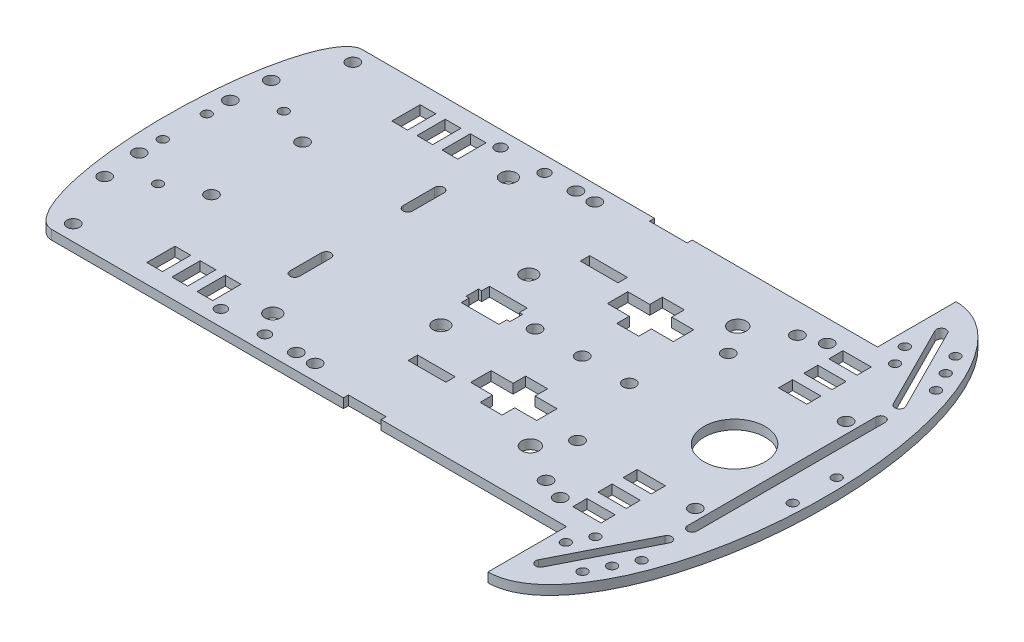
SolidWorks part; units mm, degrees
ref_plane "Front Plane" through (0, 0, 0) normal (0, 0, 1) x (1, 0, 0)
ref_plane "Top Plane" through (0, 0, 0) normal (0, 1, 0) x (1, 0, 0)
ref_plane "Right Plane" through (0, 0, 0) normal (1, 0, 0) x (0, 0, -1)
sketch "Sketch1" plane through (0, 0, 0) normal (0, 1, 0) x (1, 0, 0)
  line L1 (0, 0) -> (210, 0)
  line L2 (0, 0) -> (0, 149)
  line L3 (0, 149) -> (210, 149)
  line L4 (210, 0) -> (210, 149)
  dimension "D1" = 210
  dimension "D2" = 149
extrude "Boss-Extrude1" add sketch "Sketch1" along normal blind 3
sketch "Sketch2" plane through (0, 3, 0) normal (0, 1, 0) x (1, 0, 0)
  line L0 (210, 149) -> (0, 149) construction
  line L1 (177, 149) -> (0, 149)
  line L2 (177, 149) -> (177, 124)
  line L3 (177, 124) -> (0, 124)
  line L4 (0, 149) -> (0, 124)
  line L5 (0, 149) -> (0, 0) construction
  line L7 (0, 0) -> (177, 0)
  line L8 (0, 0) -> (0, 25)
  line L9 (0, 25) -> (177, 25)
  line L10 (177, 0) -> (177, 25)
  dimension "D1" = 177
  dimension "D2" = 25
  dimension "D3" = 25
extrude "Cut-Extrude1" cut sketch "Sketch2" against normal blind 3
sketch "Sketch3" plane through (0, 3, 0) normal (0, 1, 0) x (1, 0, 0)
  line L0 (0, 124) -> (177, 124) construction
  line L1 (143, 99.5) -> (122, 99.5)
  line L2 (143, 99.5) -> (143, 93)
  line L3 (143, 93) -> (122, 93)
  line L4 (122, 99.5) -> (122, 93)
  line L5 (129, 103.5) -> (136, 103.5)
  line L6 (129, 103.5) -> (129, 89)
  line L7 (129, 89) -> (136, 89)
  line L8 (136, 103.5) -> (136, 89)
  line L9 (177, 124) -> (177, 149) construction
  line L10 (118, 124) -> (106, 124)
  line L11 (118, 124) -> (118, 122.4)
  line L12 (118, 122.4) -> (106, 122.4)
  line L13 (106, 124) -> (106, 122.4)
  line L14 (210, 74.5) -> (0, 74.5) construction
  line L15 (118, 103.4) -> (106, 103.4)
  line L16 (118, 103.4) -> (118, 100.4)
  line L17 (118, 100.4) -> (106, 100.4)
  line L18 (106, 103.4) -> (106, 100.4)
  line L19 (181.5, 117.5) -> (172.5, 117.5)
  line L20 (181.5, 117.5) -> (181.5, 113)
  line L21 (181.5, 113) -> (172.5, 113)
  line L22 (172.5, 117.5) -> (172.5, 113)
  line L23 (172.5, 109.5) -> (181.5, 109.5)
  line L24 (172.5, 109.5) -> (172.5, 105)
  line L25 (172.5, 105) -> (181.5, 105)
  line L26 (181.5, 109.5) -> (181.5, 105)
  line L27 (172.5, 101.5) -> (181.5, 101.5)
  line L28 (172.5, 101.5) -> (172.5, 97)
  line L29 (172.5, 97) -> (181.5, 97)
  line L30 (181.5, 101.5) -> (181.5, 97)
  line L31 (210, 0) -> (210, 149) construction
  line L32 (0, 124) -> (0, 25) construction
  line L33 (181.5, 47.5) -> (181.5, 52)
  line L34 (172.5, 52) -> (181.5, 52)
  line L35 (172.5, 47.5) -> (172.5, 52)
  line L36 (172.5, 47.5) -> (181.5, 47.5)
  line L37 (181.5, 39.5) -> (181.5, 44)
  line L38 (172.5, 44) -> (181.5, 44)
  line L39 (172.5, 39.5) -> (172.5, 44)
  line L40 (172.5, 39.5) -> (181.5, 39.5)
  line L41 (172.5, 31.5) -> (172.5, 36)
  line L42 (181.5, 36) -> (172.5, 36)
  line L43 (181.5, 31.5) -> (181.5, 36)
  line L44 (181.5, 31.5) -> (172.5, 31.5)
  line L45 (106, 45.6) -> (106, 48.6)
  line L46 (118, 48.6) -> (106, 48.6)
  line L47 (118, 45.6) -> (118, 48.6)
  line L48 (118, 45.6) -> (106, 45.6)
  line L49 (106, 25) -> (106, 26.6)
  line L50 (118, 26.6) -> (106, 26.6)
  line L51 (118, 25) -> (118, 26.6)
  line L52 (118, 25) -> (106, 25)
  line L53 (136, 45.5) -> (136, 60)
  line L54 (129, 60) -> (136, 60)
  line L55 (129, 45.5) -> (129, 60)
  line L56 (129, 45.5) -> (136, 45.5)
  line L57 (122, 49.5) -> (122, 56)
  line L58 (143, 56) -> (122, 56)
  line L59 (143, 49.5) -> (143, 56)
  line L60 (143, 49.5) -> (122, 49.5)
  circle A0 centre (149, 107.5) radius 2.75
  circle A1 centre (168, 117) radius 2
  circle A2 centre (161, 114.5) radius 2
  circle A3 centre (155, 98.5) radius 2
  circle A4 centre (155, 50.5) radius 2
  circle A5 centre (161, 34.5) radius 2
  circle A6 centre (168, 32) radius 2
  circle A7 centre (149, 41.5) radius 2.75
  dimension "D16" = 5.5
  dimension "D19" = 9
  dimension "D21" = 4
  dimension "D25" = 4
  dimension "D27" = 4
  dimension "D1" = 34
  dimension "D2" = 6.5
  dimension "D3" = 24.5
  dimension "D4" = 21
  dimension "D5" = 7
  dimension "D6" = 7
  dimension "D7" = 4
  dimension "D8" = 4
  dimension "D9" = 59
  dimension "D10" = 12
  dimension "D11" = 1.6
  dimension "D12" = 3
  dimension "D13" = 19
  dimension "D14" = 12
  dimension "D15" = 59
  dimension "D17" = 28
  dimension "D18" = 16.5
  dimension "D20" = 7
  dimension "D22" = 16
  dimension "D23" = 9.5
  dimension "D24" = 25.5
  dimension "D26" = 22
  dimension "D28" = 4.5
  dimension "D29" = 9
  dimension "D30" = 4.5
  dimension "D31" = 6.5
  dimension "D32" = 4.5
  dimension "D33" = 3.5
  dimension "D34" = 9
  dimension "D35" = 4.5
  dimension "D36" = 3.5
extrude "Cut-Extrude2" cut sketch "Sketch3" against normal blind 3 contours L15 L18 L17 L16 | L6 L1 L4 L3 | L8 L1 L6 L3 | L1 L8 L3 L2 | L8 L3 L6 L7 | L8 L5 L6 L1 | A3 | A0 | A2 | A1 | L19 L22 L21 L20 | L26 L23 L24 L25 | L30 L27 L28 L29 | L48 L47 L46 L45 | L10 L13 L12 L11 | L50 L49 L52 L51 | L55 L54 L53 L56 | L58 L57 L60 L59 | A7 | A4 | A5 | A6 | L34 L33 L36 L35 | L38 L37 L40 L39 | L42 L41 L44 L43
sketch "Sketch4" plane through (0, 3, 0) normal (0, 1, 0) x (1, 0, 0)
  line L0 (0, 124) -> (106, 124) construction
  line L1 (106, 124) -> (106, 122.4) construction
  line L2 (106, 124) -> (106, 122.4) construction
  line L3 (210, 74.5) -> (0, 74.5) construction
  line L4 (210, 0) -> (210, 149) construction
  line L5 (0, 124) -> (0, 25) construction
  circle A0 centre (92, 119) radius 2
  circle A1 centre (86, 119) radius 2
  circle A2 centre (76, 119) radius 1.75
  circle A3 centre (62, 119) radius 1.75
  circle A4 centre (71.5, 112) radius 2.5
  circle A5 centre (71.5, 37) radius 2.5
  circle A6 centre (62, 30) radius 1.75
  circle A7 centre (76, 30) radius 1.75
  circle A8 centre (86, 30) radius 2
  circle A9 centre (92, 30) radius 2
  circle A10 centre (15, 119) radius 2
  circle A11 centre (15, 30) radius 2
  point P11 (106, 123.2)
  point P16 (106, 123.2)
  dimension "D1" = 4
  dimension "D2" = 4
  dimension "D6" = 5
  dimension "D8" = 3.5
  dimension "D12" = 3.5
  dimension "D13" = 5
  dimension "D17" = 4
  dimension "D3" = 6
  dimension "D4" = 14
  dimension "D5" = 5
  dimension "D7" = 30
  dimension "D9" = 5
  dimension "D10" = 14
  dimension "D11" = 5
  dimension "D14" = 34.5
  dimension "D15" = 12
  dimension "D16" = 47
  dimension "D18" = 5
extrude "Cut-Extrude3" cut sketch "Sketch4" against normal blind 3
sketch "Sketch5" plane through (0, 3, 0) normal (0, 1, 0) x (1, 0, 0)
  line L0 (0, 124) -> (106, 124) construction
  line L1 (58.4, 118) -> (53.4, 118)
  line L2 (58.4, 118) -> (58.4, 109)
  line L3 (58.4, 109) -> (53.4, 109)
  line L4 (53.4, 118) -> (53.4, 109)
  line L5 (0, 74.5) -> (210, 74.5) construction
  line L6 (50.4, 118) -> (45.4, 118)
  line L7 (50.4, 118) -> (50.4, 109)
  line L8 (50.4, 109) -> (45.4, 109)
  line L9 (45.4, 118) -> (45.4, 109)
  line L10 (42.4, 118) -> (37.4, 118)
  line L11 (42.4, 118) -> (42.4, 109)
  line L12 (42.4, 109) -> (37.4, 109)
  line L13 (37.4, 118) -> (37.4, 109)
  line L14 (0, 124) -> (0, 25) construction
  line L15 (210, 0) -> (210, 149) construction
  line L16 (37.4, 31) -> (37.4, 40)
  line L17 (42.4, 40) -> (37.4, 40)
  line L18 (42.4, 31) -> (42.4, 40)
  line L19 (42.4, 31) -> (37.4, 31)
  line L20 (45.4, 31) -> (45.4, 40)
  line L21 (50.4, 40) -> (45.4, 40)
  line L22 (50.4, 31) -> (50.4, 40)
  line L23 (50.4, 31) -> (45.4, 31)
  line L24 (53.4, 31) -> (53.4, 40)
  line L25 (58.4, 40) -> (53.4, 40)
  line L26 (58.4, 31) -> (58.4, 40)
  line L27 (58.4, 31) -> (53.4, 31)
  dimension "D1" = 5
  dimension "D2" = 9
  dimension "D3" = 47.6
  dimension "D4" = 6
  dimension "D5" = 5
  dimension "D6" = 5
  dimension "D7" = 3
  dimension "D8" = 3
  dimension "D9" = 9
  dimension "D10" = 9
extrude "Cut-Extrude4" cut sketch "Sketch5" against normal blind 3
sketch "Sketch6" plane through (0, 3, 0) normal (0, 1, 0) x (1, 0, 0)
  line L0 (0, 74.5) -> (210, 74.5) construction
  line L1 (0, 124) -> (0, 25) construction
  line L2 (210, 0) -> (210, 149) construction
  line L3 (29, 60) -> (29, 89)
  line L4 (29, 60) -> (6, 60)
  line L5 (29, 89) -> (6, 89)
  line L6 (6, 60) -> (6, 89)
  line L7 (29, 60) -> (6, 89) construction
  line L8 (29, 89) -> (6, 60) construction
  line L9 (0, 74.5) -> (46.1912, 74.5) construction
  circle A0 centre (6, 89) radius 2
  circle A1 centre (29, 89) radius 2
  circle A2 centre (29, 60) radius 2
  circle A3 centre (6, 60) radius 2
  circle A4 centre (6, 81.5) radius 1.5
  circle A5 centre (6, 67.5) radius 1.5
  circle A6 centre (7, 48) radius 2
  circle A7 centre (17.5, 54.5) radius 1.5
  circle A8 centre (17.5, 94.5) radius 1.5
  circle A9 centre (7, 101) radius 2
  point P7 (17.5, 74.5)
  dimension "D4" = 4
  dimension "D5" = 4
  dimension "D6" = 4
  dimension "D7" = 4
  dimension "D8" = 3
  dimension "D9" = 3
  dimension "D12" = 12
  dimension "D14" = 20
  dimension "D1" = 29
  dimension "D2" = 23
  dimension "D3" = 6
  dimension "D10" = 14
  dimension "D11" = 7
  dimension "D13" = 1
sketch "Sketch7" plane through (0, 3, 0) normal (0, 1, 0) x (1, 0, 0)
  line L0 (0, 74.5) -> (210, 74.5) construction
  line L1 (210, 0) -> (210, 149) construction
  line L2 (172.5, 101.5) -> (172.5, 97) construction
  line L3 (106, 103.4) -> (106, 100.4) construction
  line L4 (98.5, 79) -> (110.5, 79)
  line L5 (98.5, 79) -> (98.5, 70)
  line L6 (98.5, 70) -> (110.5, 70)
  line L7 (110.5, 79) -> (110.5, 70)
  line L8 (97.5, 76.5) -> (111.5, 76.5)
  line L9 (97.5, 76.5) -> (97.5, 72.5)
  line L10 (97.5, 72.5) -> (111.5, 72.5)
  line L11 (111.5, 76.5) -> (111.5, 72.5)
  line L12 (77.2099, 74.5) -> (123.0417, 74.5) construction
  circle A0 centre (181, 74.5) radius 9.75
  circle A1 centre (132.5, 74.5) radius 2
  circle A2 centre (147.5, 74.5) radius 2
  circle A3 centre (117.5, 74.5) radius 2
  circle A4 centre (101.5, 88.5) radius 2.5
  circle A5 centre (101.5, 60.5) radius 2.5
  point P28 (106, 101.9)
  dimension "D1" = 19.5
  dimension "D3" = 15
  dimension "D16" = 5
  dimension "D2" = 29
  dimension "D4" = 15
  dimension "D5" = 3.5
  dimension "D6" = 9
  dimension "D7" = 4.5
  dimension "D8" = 12
  dimension "D9" = 14
  dimension "D10" = 4
  dimension "D11" = 2
  dimension "D12" = 1
  dimension "D13" = 6
  dimension "D14" = 14
  dimension "D15" = 4.5
extrude "Cut-Extrude5" cut sketch "Sketch7" against normal blind 3 contours A4 | A5 | L10 L5 L6 L7 | A3 | A1 | A2 | A0
extrude "Cut-Extrude6" cut sketch "Sketch6" against normal blind 3 contours A9 | A8 | A0 | A1 | A2 | A4 | A5 | A3 | A7 | A6
sketch "Sketch8" plane through (0, 3, 0) normal (0, 1, 0) x (1, 0, 0)
  line L0 (64, 97.5) -> (64, 87.5) construction
  line L1 (65.5, 97.5) -> (65.5, 87.5)
  line L2 (62.5, 97.5) -> (62.5, 87.5)
  line L3 (0, 74.5) -> (210, 74.5) construction
  line L4 (0, 124) -> (0, 25) construction
  line L5 (210, 0) -> (210, 149) construction
  line L6 (0, 124) -> (106, 124) construction
  line L7 (98.5, 79) -> (98.5, 76.5) construction
  line L8 (36.7858, 74.5) -> (83.2541, 74.5) construction
  line L9 (64, 51.5) -> (64, 61.5) construction
  line L10 (65.5, 51.5) -> (65.5, 61.5)
  line L11 (62.5, 51.5) -> (62.5, 61.5)
  arc A0 (65.5, 97.5) -> (62.5, 97.5) centre (64, 97.5) ccw
  arc A1 (62.5, 87.5) -> (65.5, 87.5) centre (64, 87.5) ccw
  circle A2 centre (29, 89) radius 2 construction
  arc A3 (65.5, 51.5) -> (62.5, 51.5) centre (64, 51.5) cw
  arc A4 (62.5, 61.5) -> (65.5, 61.5) centre (64, 61.5) cw
  point P2 (64, 92.5)
  point P17 (98.5, 77.75)
  point P24 (64, 56.5)
  dimension "D1" = 1.5
  dimension "D2" = 10
  dimension "D3" = 13
  dimension "D4" = 26.5
  dimension "D5" = 35
  dimension "D6" = 34.5
extrude "Cut-Extrude7" cut sketch "Sketch8" against normal blind 3
sketch "Sketch9" plane through (0, 3, 0) normal (0, 1, 0) x (1, 0, 0)
  line L0 (210, 74.5) -> (157.0079, 74.5) construction
  line L1 (210, 0) -> (210, 149) construction
  line L2 (197.5, 104.5) -> (197.5, 44.5) construction
  line L3 (199, 104.5) -> (199, 44.5)
  line L4 (196, 104.5) -> (196, 44.5)
  line L5 (196.5, 111.5) -> (183, 138.2909) construction
  line L6 (195.1605, 110.825) -> (181.6605, 137.6159)
  line L7 (197.8395, 112.175) -> (184.3395, 138.9659)
  line L8 (177, 124) -> (177, 149) construction
  line L9 (195.1082, 127.5954) -> (189.75, 124.8954) construction
  line L10 (183, 138.2909) -> (196.5, 111.5) construction
  line L11 (191.9582, 133.8466) -> (195.1082, 127.5954) construction
  line L12 (195.1082, 127.5954) -> (200.2073, 117.4762) construction
  line L13 (195.1082, 127.5954) -> (189.75, 124.8954) construction
  line L14 (189.75, 124.8954) -> (183, 121.4941) construction
  line L15 (191.9582, 133.8466) -> (180.4567, 128.051) construction
  line L16 (196.5, 37.5) -> (183, 10.7091) construction
  line L17 (195.1605, 38.175) -> (181.6605, 11.3841)
  line L18 (197.8395, 36.825) -> (184.3395, 10.0341)
  arc A0 (199, 104.5) -> (196, 104.5) centre (197.5, 104.5) ccw
  arc A1 (196, 44.5) -> (199, 44.5) centre (197.5, 44.5) ccw
  circle A2 centre (181, 74.5) radius 9.75 construction
  arc A3 (195.1605, 110.825) -> (197.8395, 112.175) centre (196.5, 111.5) ccw
  arc A4 (184.3395, 138.9659) -> (181.6605, 137.6159) centre (183, 138.2909) ccw
  circle A5 centre (195.1082, 127.5954) radius 1.5
  circle A6 centre (191.9582, 133.8466) radius 1.5
  circle A7 centre (198.2582, 121.3442) radius 1.5
  circle A8 centre (184.3918, 122.1954) radius 1.5
  circle A9 centre (181.2418, 128.4466) radius 1.5
  circle A10 centre (192.5, 98.5) radius 2
  circle A11 centre (206.5, 81.5) radius 1.5
  circle A12 centre (192.5, 50.5) radius 2
  circle A13 centre (184.3918, 26.8046) radius 1.5
  circle A14 centre (181.2418, 20.5534) radius 1.5
  circle A15 centre (191.9582, 15.1534) radius 1.5
  circle A16 centre (195.1082, 21.4046) radius 1.5
  circle A17 centre (198.2582, 27.6558) radius 1.5
  arc A18 (195.1605, 38.175) -> (197.8395, 36.825) centre (196.5, 37.5) cw
  arc A19 (184.3395, 10.0341) -> (181.6605, 11.3841) centre (183, 10.7091) cw
  circle A20 centre (206.5, 67.5) radius 1.5
  point P6 (197.5, 74.5)
  point P15 (189.75, 124.8954)
  point P56 (189.75, 24.1046)
  dimension "D4" = 15
  dimension "D3" = 1.5
  dimension "D9" = 1.5
  dimension "D10" = 3
  dimension "D14" = 3
  dimension "D18" = 6
  dimension "D16" = 3
  dimension "D17" = 3
  dimension "D19" = 6
  dimension "D20" = 3
  dimension "D23" = 4
  dimension "D25" = 3
  dimension "D1" = 60
  dimension "D2" = 30
  dimension "D5" = 30
  dimension "D6" = 1
  dimension "D7" = 7
  dimension "D8" = 6
  dimension "D11" = 6
  dimension "D12" = 7
  dimension "D13" = 6
  dimension "D15" = 7
  dimension "D21" = 24
  dimension "D22" = 5
  dimension "D24" = 7
  dimension "D26" = 9
extrude "Cut-Extrude8" cut sketch "Sketch9" against normal blind 3
sketch "Sketch11" plane through (0, 3, 0) normal (0, 1, 0) x (1, 0, 0)
  line L0 (210, 0) -> (210, 149) construction
  line L1 (177, 149) -> (210, 149)
  line L2 (210, 149) -> (210, 0)
  line L3 (210, 0) -> (177, 0)
  ellipse E0 centre (177, 74.5) end of major axis (177, 149) minor radius 33
extrude "Cut-Extrude9" cut sketch "Sketch11" against normal blind 3 contours E0 L2 L1 | E0 L3 L2
sketch "Sketch12" plane through (0, 3, 0) normal (0, 1, 0) x (1, 0, 0)
  line L0 (0, 124) -> (106, 124) construction
  line L1 (13, 124) -> (0, 124)
  line L2 (0, 124) -> (0, 74.5)
  line L3 (0, 124) -> (0, 25) construction
  line L4 (0, 74.5) -> (0, 25)
  line L5 (0, 25) -> (13, 25)
  ellipse E0 centre (13, 74.5) end of major axis (13, 124) minor radius 13
  dimension "D1" = 13
extrude "Cut-Extrude10" cut sketch "Sketch12" against normal blind 3 contours E0 L1 L2 | E0 L4 L5
